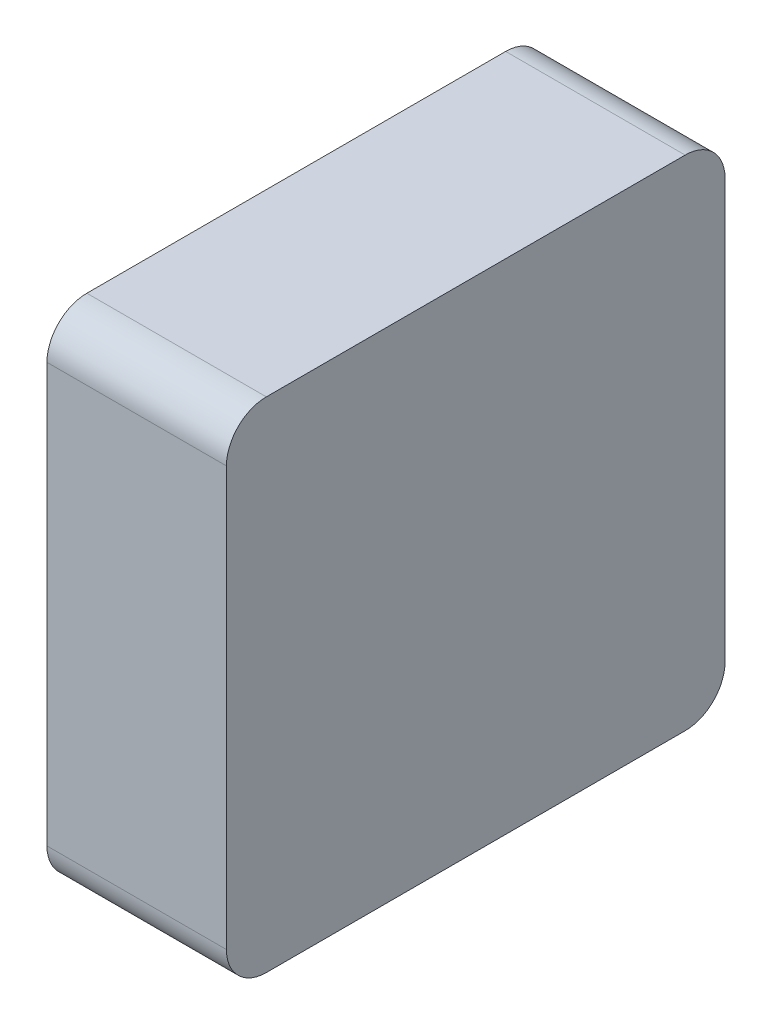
SolidWorks part; units mm, degrees
ref_plane "Front Plane" through (0, 0, 0) normal (0, 0, 1) x (1, 0, 0)
ref_plane "Top Plane" through (0, 0, 0) normal (0, 1, 0) x (1, 0, 0)
ref_plane "Right Plane" through (0, 0, 0) normal (1, 0, 0) x (0, 0, -1)
body saved out of another part "Stock-Pump Coupling-1"
fillet "Fillet1" radius 20 4 edges at (61, -125, -125) (61, 125, -125) (61, -125, 125) (61, 125, 125)
